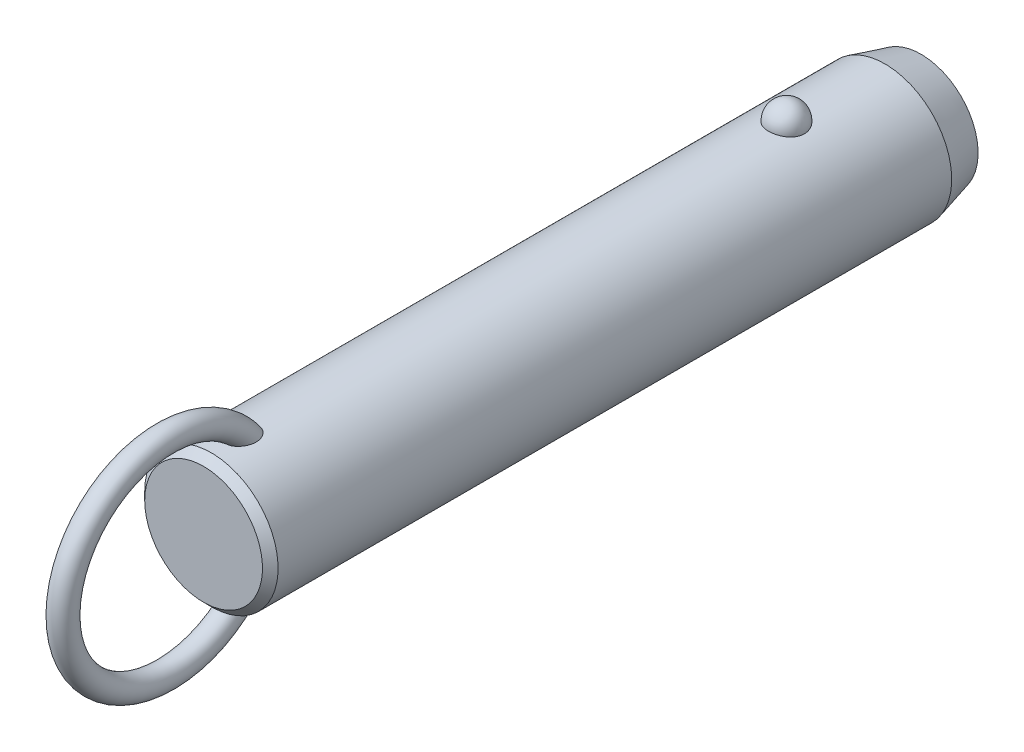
SolidWorks part; units mm, degrees
ref_plane "Front Plane" through (0, 0, 0) normal (0, 0, 1) x (1, 0, 0)
ref_plane "Top Plane" through (0, 0, 0) normal (0, 1, 0) x (1, 0, 0)
ref_plane "Right Plane" through (0, 0, 0) normal (1, 0, 0) x (0, 0, -1)
sketch "Sketch2" plane through (0, 0, 0) normal (0, 0, 1) x (1, 0, 0)
  circle A0 centre (0, 0) radius 11.1
  point P3 (0, 11.1)
  dimension "D1" = 22.2
extrude "Boss-Extrude1" add sketch "Sketch2" along normal blind 81.3
sketch "Sketch3" plane through (0, 0, 0) normal (0, 0, -1) x (-1, 0, 0)
  circle A0 centre (0, 0) radius 11.1
  dimension "D1" = 22.2
extrude "Boss-Extrude2" add sketch "Sketch3" along normal blind 25.4
chamfer "Chamfer1" distance 6 angle 15 1 edges at (-11.1, 0, -25.4)
sketch "Sketch12" plane through (0, 0, 0) normal (1, 0, 0) x (0, 0, -1)
  line L0 (-81.3, 11.1) -> (-81.3, -11.1) construction
  point P0 (-81.3, 0)
sketch "Sketch13" plane through (0, 0, 0) normal (1, 0, 0) x (0, 0, -1)
  circle A0 centre (-100.35, 0) radius 19.05
  point P2 (-81.3, 0)
  dimension "D1" = 38.1
sketch "Sketch14" plane through (0, 0, 0) normal (0, 1, 0) x (1, 0, 0)
  circle A0 centre (0, -83.3) radius 2
  point P2 (0, -81.3)
  dimension "D1" = 4
sweep "Sweep1" add profiles "Sketch14" path "Sketch13"
sketch "Sketch15" plane through (0, 0, 81.3) normal (0, 0, 1) x (1, 0, 0)
  circle A0 centre (0, 0) radius 11.1
  dimension "D1" = 22.2
extrude "Boss-Extrude3" add sketch "Sketch15" along normal blind 12.7
chamfer "Chamfer2" distance 1.3 angle 45 1 edges at (11.1, 0, 94)
sketch "Sketch18" plane through (0, 0, 0) normal (1, 0, 0) x (0, 0, -1)
  line L0 (19.4, 11.1) -> (-84.868, 11.1) construction
  line L1 (3, 14.1) -> (3, 8.1)
  line L2 (-84.868, -11.1) -> (19.4, -11.1) construction
  arc A0 (3, 14.1) -> (3, 8.1) centre (3, 11.1) ccw
  point P4 (0, 11.1)
  dimension "D1" = 25.2
revolve "Revolve1" add sketch "Sketch18" angle 360 about L1
